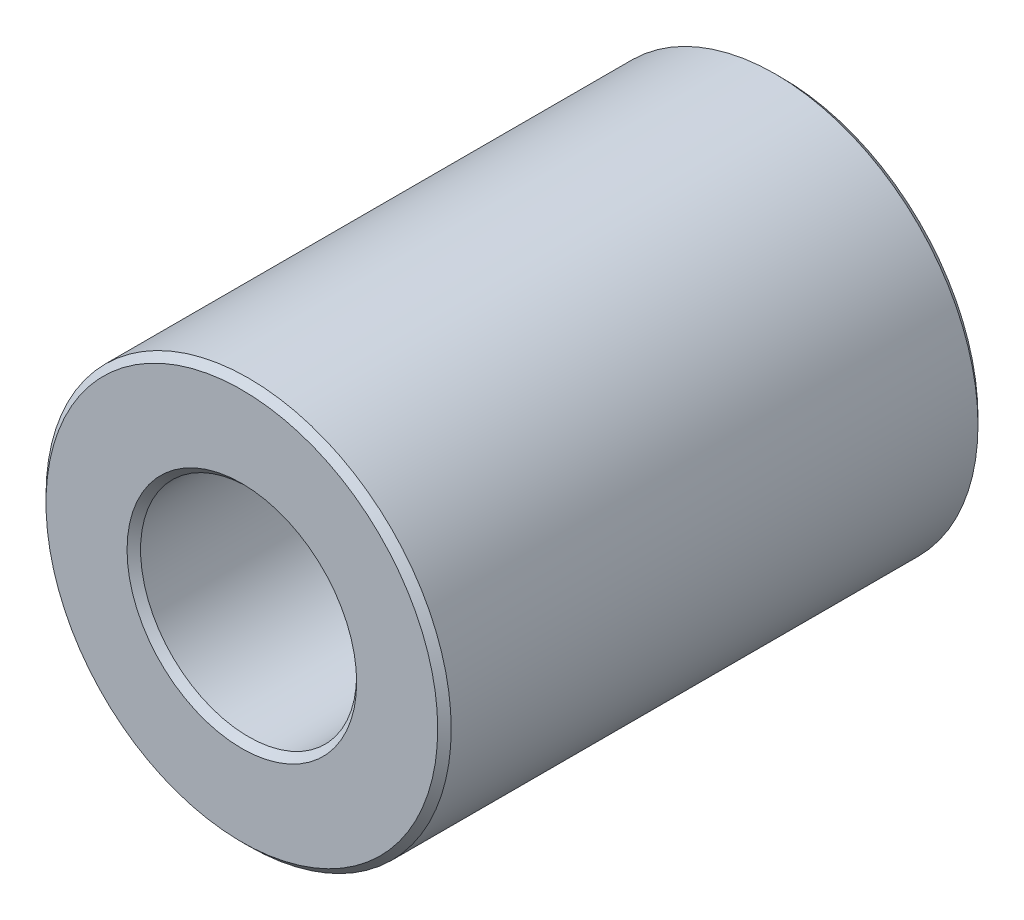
SolidWorks part; units mm, degrees
ref_plane "Front Plane" through (0, 0, 0) normal (0, 0, 1) x (1, 0, 0)
ref_plane "Top Plane" through (0, 0, 0) normal (0, 1, 0) x (1, 0, 0)
ref_plane "Right Plane" through (0, 0, 0) normal (1, 0, 0) x (0, 0, -1)
sketch "Sketch1" plane through (0, 0, 0) normal (0, 0, 1) x (1, 0, 0)
  circle A0 centre (0, 0) radius 3
  circle A1 centre (0, 0) radius 1.6
  dimension "D1" = 6
  dimension "D2" = 3.2
extrude "Boss-Extrude2" add sketch "Sketch1" along normal mid plane 8
chamfer "Chamfer3" distance 0.1 angle 45 4 edges at (3, 0, 4) (3, 0, -4) (1.6, 0, -4) (1.6, 0, 4)
